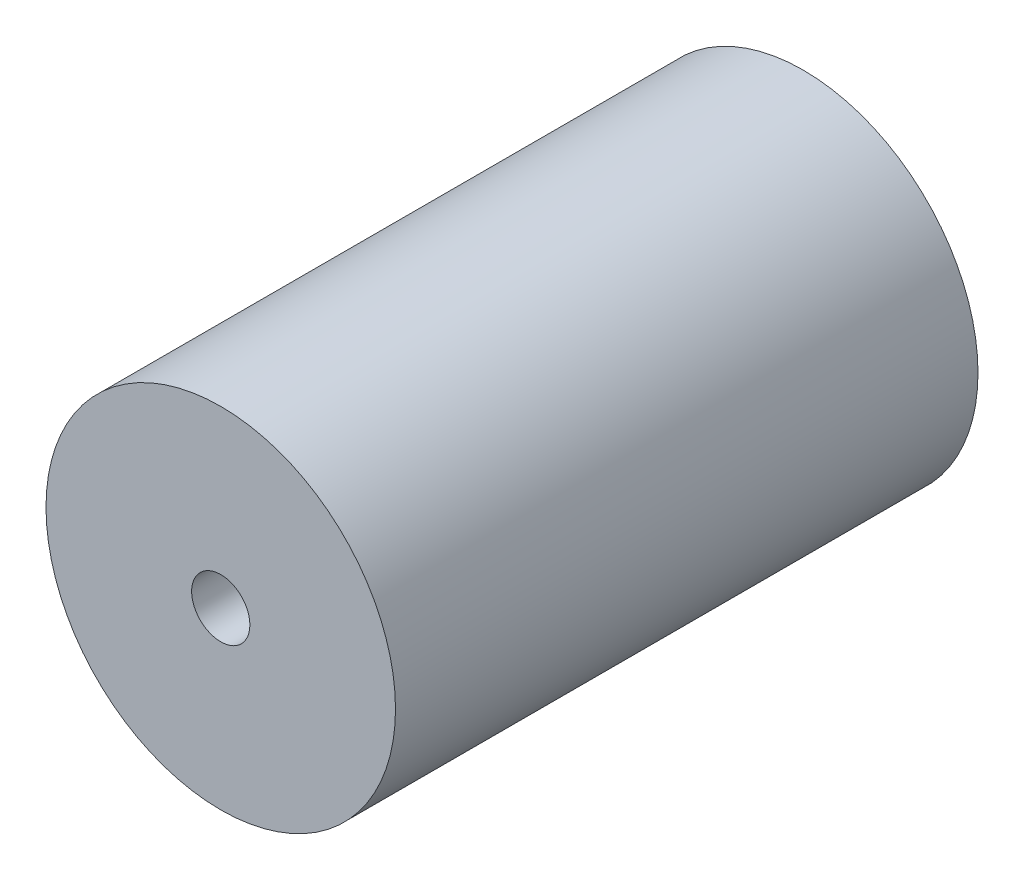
SolidWorks part; units mm, degrees
ref_plane "Plan de face" through (0, 0, 0) normal (0, 0, 1) x (1, 0, 0)
ref_plane "Plan de dessus" through (0, 0, 0) normal (0, 1, 0) x (1, 0, 0)
ref_plane "Plan de droite" through (0, 0, 0) normal (1, 0, 0) x (0, 0, -1)
sketch "Esquisse1" plane through (0, 0, 0) normal (0, 0, 1) x (1, 0, 0)
  circle A0 centre (0, 0) radius 15
  dimension "D1" = 30
extrude "Extrusion1" add sketch "Esquisse1" along normal blind 50
hole_wizard "Trou taraudé M6x1.01" positions "Esquisse3" profile "Esquisse2" tap size "M6x1.0" standard "ISO"
sketch "Esquisse3" plane through (0, 0, 50) normal (0, 0, 1) x (1, 0, 0)
  point P0 (0, 0)
sketch "Esquisse2" plane through (0, 0, 50) normal (1, 0, 0) x (0, -1, 0)
  line L0 (0, 0) -> (0, 19.5022)
  line L1 (0, 19.5022) -> (2.5, 18)
  line L2 (2.5, 18) -> (2.5, 0)
  line L5 (2.5, 0) -> (0, 0)
  line L10 (0, 19.5022) -> (-2.5, 18) construction
  line L11 (0, -6.35) -> (0, 107.95) construction
  dimension "Diamètre du trou pour taraudage" = 5
  dimension "Profondeur du trou pour taraudage" = 18
  dimension "Angle de pointe" = 118
